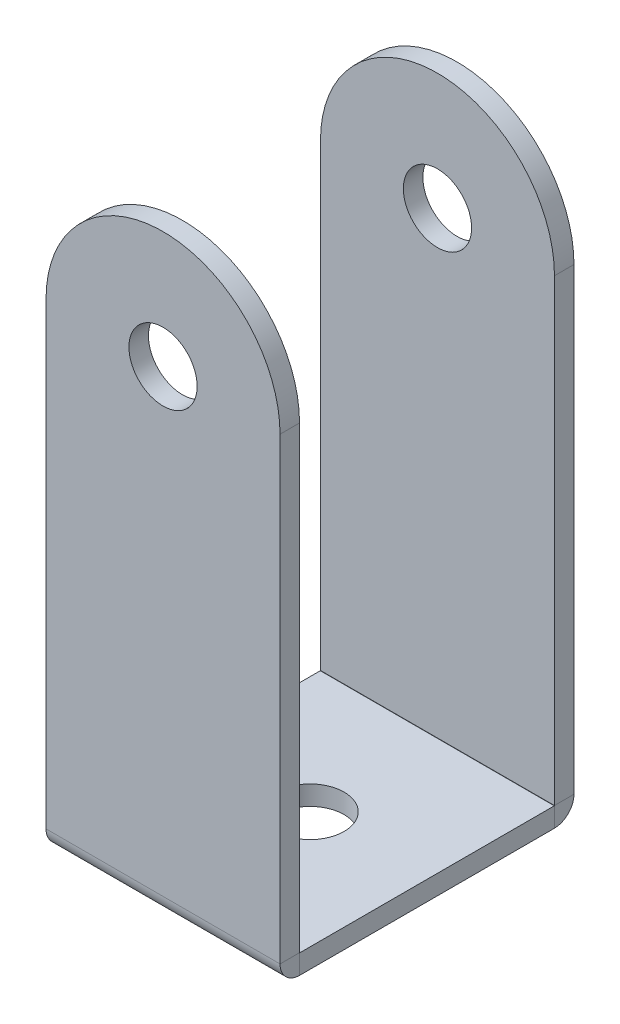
SolidWorks part; units mm, degrees
ref_plane "Front" through (0, 0, 0) normal (0, 0, 1) x (1, 0, 0)
ref_plane "Top" through (0, 0, 0) normal (0, 1, 0) x (1, 0, 0)
ref_plane "Right" through (0, 0, 0) normal (1, 0, 0) x (0, 0, -1)
sketch "Sketch1" plane through (0, 0, 0) normal (0, 0, 1) x (1, 0, 0)
  line L1 (6, 19.8073) -> (6, -42.1927)
  line L2 (-6, 19.8073) -> (-6, -42.1927)
  arc A0 (6, 19.8073) -> (-6, 19.8073) centre (0, 19.8073) ccw
  circle A1 centre (0, 19.8073) radius 1.75
  circle A2 centre (0, -42.1927) radius 1.75
  arc A3 (-6, -42.1927) -> (6, -42.1927) centre (0, -42.1927) ccw
  circle A4 centre (0, -11.1927) radius 1.75
sheet metal parameters "Sheet-Metal1" thickness 1 parameters "D1"=0.01
base flange "Base-Flange1" sketch "Sketch1" thickness 1 reverse thickness direction yes parameters "D1"=0.01
sketch "Sketch3" plane through (0, 0, 1) normal (0, 0, 1) x (1, 0, 0)
  line L3 (-6, -18.1927) -> (6, -18.1927)
  line L4 (-6, -4.1927) -> (6, -4.1927)
sketched bend "Sketched Bend1" parameters "D1"=0
bend "SketchBend1" bend radius 0.01 bend angle 90 parameters "D5"=1
bend "SketchBend2" bend radius 0 bend angle 90 parameters "D5"=2
flat pattern "Flat-Pattern1"
sketch "Bend-Lines1" plane through (0, 0, 1) normal (0, 0, 1) x (1, 0, 0)
  line L0 (6, -4.1927) -> (-6, -4.1927) construction
  line L1 (6, -18.1927) -> (-6, -18.1927) construction
bend of the flat pattern "Flatten-<SketchBend1>1"
bend of the flat pattern "Flatten-<SketchBend2>1"
